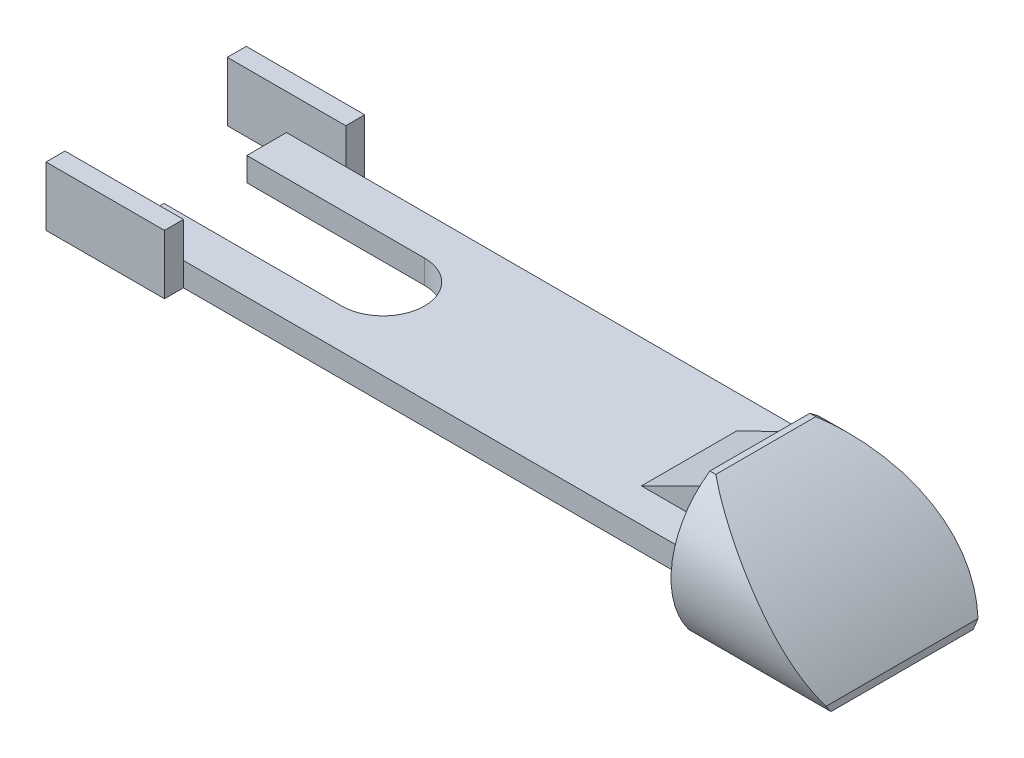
SolidWorks part; units mm, degrees
ref_plane "Front Plane" through (0, 0, 0) normal (0, 0, 1) x (1, 0, 0)
ref_plane "Top Plane" through (0, 0, 0) normal (0, 1, 0) x (1, 0, 0)
ref_plane "Right Plane" through (0, 0, 0) normal (1, 0, 0) x (0, 0, -1)
sketch "Sketch1" plane through (0, 0, 0) normal (0, 1, 0) x (1, 0, 0)
  line L1 (-29.718, -8.6995) -> (29.718, -8.6995)
  line L2 (-29.718, -8.6995) -> (-29.718, 8.6995)
  line L3 (-29.718, 8.6995) -> (29.718, 8.6995)
  line L4 (29.718, -8.6995) -> (29.718, 8.6995)
  line L5 (-29.718, -8.6995) -> (29.718, 8.6995) construction
  line L6 (-29.718, 8.6995) -> (29.718, -8.6995) construction
  point P0 (0, 0)
  dimension "D1" = 59.436
  dimension "D2" = 17.399
extrude "Boss-Extrude1" add sketch "Sketch1" along normal blind 2.54
sketch "Sketch2" plane through (0, 2.54, 0) normal (0, 1, 0) x (1, 0, 0)
  line L0 (0, 0) -> (-6.223, 0) construction
  line L1 (-29.718, 8.6995) -> (-29.718, -8.6995) construction
  line L2 (-29.718, -4.445) -> (-10.668, -4.445)
  line L3 (-29.718, -4.445) -> (-29.718, 4.445)
  line L4 (-29.718, 4.445) -> (-10.668, 4.445)
  line L6 (-16.5677, 0) -> (-25.3249, 0) construction
  arc A0 (-10.668, 4.445) -> (-10.668, -4.445) centre (-10.668, 0) cw
  dimension "D1" = 19.05
  dimension "D2" = 8.89
extrude "Cut-Extrude1" cut sketch "Sketch2" against normal through all
sketch "Sketch3" plane through (0, 0, 8.6995) normal (0, 0, 1) x (1, 0, 0)
  line L0 (-29.718, 0) -> (29.718, 0) construction
  line L1 (-23.368, 0) -> (-36.068, 0)
  line L2 (-23.368, 0) -> (-23.368, 6.35)
  line L3 (-23.368, 6.35) -> (-36.068, 6.35)
  line L4 (-36.068, 0) -> (-36.068, 6.35)
  line L5 (-29.718, 2.54) -> (-29.718, 0) construction
  dimension "D1" = 12.7
  dimension "D2" = 6.35
  dimension "D3" = 6.35
extrude "Boss-Extrude2" add sketch "Sketch3" along normal blind 2.032
mirror "Mirror1" about plane through (0, 0, 0) normal (0, 0, 1) of "Boss-Extrude2"
sketch "Sketch6" plane through (29.718, 0, 0) normal (1, 0, 0) x (0, 0, -1)
  line L0 (-5.3594, 7.8742) -> (5.3594, 7.8742)
  line L1 (-7.62, -5.715) -> (7.62, -5.715)
  line L2 (-8.6995, 0) -> (8.6995, 0) construction
  arc A0 (7.62, -5.715) -> (5.3594, 7.8742) centre (0, 0) ccw
  arc A1 (-5.3594, 7.8742) -> (-7.62, -5.715) centre (0, 0) ccw
  dimension "D1" = 9.525
  dimension "D2" = 10.7188
  dimension "D3" = 15.24
  dimension "D4" = 5.715
extrude "Boss-Extrude3" add sketch "Sketch6" along normal blind 15.24
sketch "Sketch7" plane through (0, 0, 0) normal (0, 0, 1) x (1, 0, 0)
  line L0 (44.958, 7.8742) -> (29.718, 7.8742) construction
  line L1 (44.958, -5.715) -> (44.958, 7.8742) construction
  line L2 (30.353, 7.8742) -> (29.718, 7.8742)
  line L3 (44.958, -4.953) -> (44.958, -5.715)
  arc A0 (30.353, 7.8742) -> (44.958, -4.953) centre (13.3453, -26.219) cw
  dimension "D3" = 38.1
  dimension "D1" = 0.635
  dimension "D2" = 0.762
extrude "Cut-Extrude2" cut sketch "Sketch7" against normal through all and the other way through all
sketch "Sketch12" plane through (0, 0, 0) normal (0, 0, 1) x (1, 0, 0)
  line L0 (29.718, 6.3266) -> (22.098, 2.54)
  line L1 (29.718, 7.8742) -> (29.718, -5.715) construction
  line L2 (-23.368, 2.54) -> (29.718, 2.54) construction
  dimension "D1" = 8.509
  dimension "D2" = 7.62
rib "Rib2" sketch "Sketch12" sketch "Sketch12" thickness 10.16 extrusion direction parallel to sketch draft on no parameters "D1"=10.16
